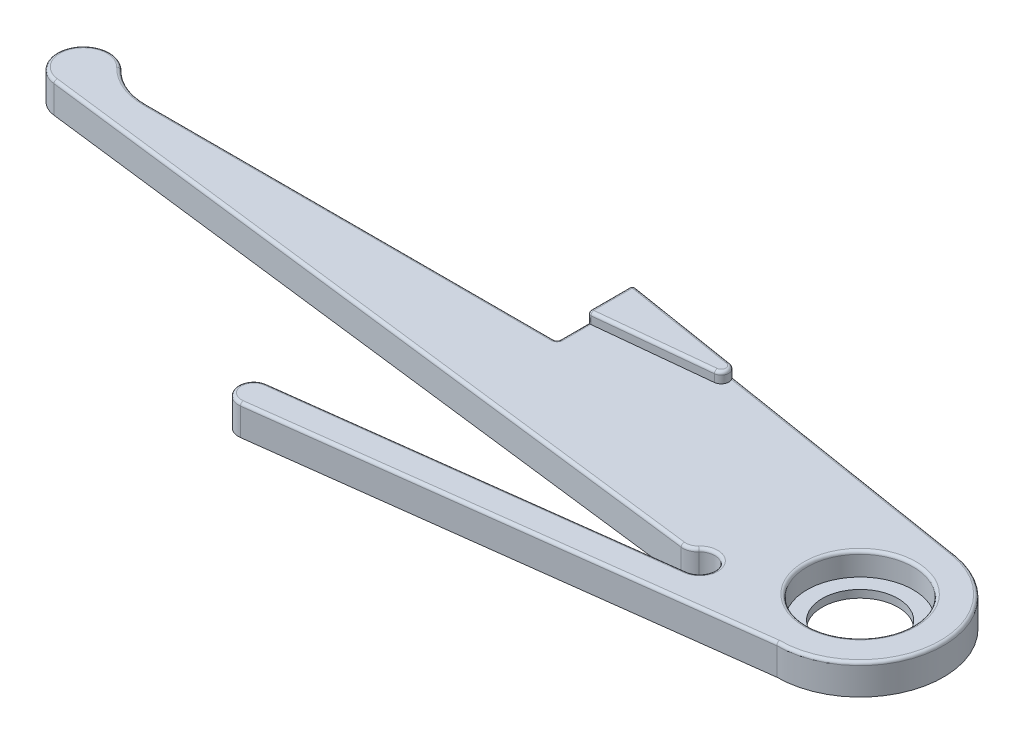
SolidWorks part; units mm, degrees
ref_plane "Спереди" through (0, 0, 0) normal (0, 0, 1) x (1, 0, 0)
ref_plane "Сверху" through (0, 0, 0) normal (0, 1, 0) x (1, 0, 0)
ref_plane "Справа" through (0, 0, 0) normal (1, 0, 0) x (0, 0, -1)
sketch "Эскиз1" plane through (0, 0, 0) normal (0, 1, 0) x (1, 0, 0)
  line L0 (97.0617, 9.5) -> (-94.7203, 9.5) construction
  line L1 (97.0617, 0) -> (-96.214, 0) construction
  line L2 (-24.5, 9.5) -> (0.871, 5.4306)
  line L3 (-24.5, 9.5) -> (-24.5, 4.5)
  line L4 (-24.5, 4.5) -> (-54, 4.5)
  line L5 (-55.9633, 2.7676) -> (-8.7824, -3.0255)
  line L6 (-7.0674, -4.3846) -> (-31.6345, -7.5161)
  line L7 (-31.3816, -9.5) -> (0, -5.5)
  line L8 (97.0617, -9.5) -> (-94.7203, -9.5) construction
  circle A0 centre (0, 0) radius 2.5
  arc A1 (0, -5.5) -> (0.871, 5.4306) centre (0, 0) ccw
  arc A2 (-54, 4.5) -> (-55.9633, 2.7676) centre (-55.75, 4.5045) ccw
  arc A3 (-8.7824, -3.0255) -> (-7.9271, -2.7128) centre (-8.6605, -2.033) ccw
  arc A4 (-7.9271, -2.7128) -> (-7.0674, -4.3846) centre (-7.1938, -3.3927) cw
  arc A6 (-31.6345, -7.5161) -> (-31.3816, -9.5) centre (-31.508, -8.508) ccw
  point P42 (-32.5, -8.6345)
  dimension "D1" = 5
  dimension "D2" = 11
  dimension "D5" = 3.5
  dimension "D8" = 63
  dimension "D9" = 1
  dimension "D11" = 1
  dimension "D3" = 9.5
  dimension "D4" = 30
  dimension "D6" = 2
  dimension "D7" = 5
  dimension "D10" = 7
  dimension "D12" = 38
extrude "Бобышка-Вытянуть1" add sketch "Эскиз1" along normal blind 2
sketch "Эскиз2" plane through (0, 2, 0) normal (0, 1, 0) x (1, 0, 0)
  line L0 (-24.5, 9.5) -> (-24.5, 6.5)
  line L1 (-24.5, 9.5) -> (-24.5, 4.5) construction
  line L2 (-24.5, 6.5) -> (-13.1155, 7.674)
  line L4 (0.871, 5.4306) -> (-24.5, 9.5) construction
  line L5 (-24.5, 9.5) -> (-13.1155, 7.674)
  dimension "D1" = 3
  dimension "D2" = 15
extrude "Бобышка-Вытянуть2" add sketch "Эскиз2" along normal blind 0.7
sketch "Эскиз3" plane through (0, 2, 0) normal (0, 1, 0) x (1, 0, 0)
  circle A0 centre (0, 0) radius 3.5
  dimension "D1" = 7
extrude "Вырез-Вытянуть1" cut sketch "Эскиз3" against normal blind 1.5
fillet "Скругление1" radius 4 1 edges at (-54, 1, -4.5)
ref_plane "Плоскость1" through (-13.1155, 2.7, -7.674) normal (0, -1, 0) x (-1, 0, 0)
fillet "Скругление2" radius 0.5 1 edges at (-13.1155, 2.35, -7.674)
fillet "Скругление3" radius 0.2 1 edges at (0, 2, 3.5)
fillet "Скругление4" radius 0.2 2 edges at (-24.5, 2.35, -6.5) (-24.5, 1.35, -9.5)
fillet "Скругление5" radius 0.2 1 edges at (-24.5, 1, -4.5)
fillet "Скругление6" radius 0.2 19 edges at (-16.4449, 2.7, -7.7677) (-20.5864, 2.7, -6.9036) (-24.434, 2.7, -6.5732) (-24.5, 2.7, -7.9935) (-24.4297, 2.7, -9.4176) (5.4826, 2, 0.4369) (-24.5, 2, -5.7108) (-24.5586, 2, -4.5586) (-15.6908, 2, 7.5) (-32.5, 2, 8.6345) (-19.3509, 2, 5.9503) (-6.3045, 2, 2.9353) (-8.3171, 2, 2.9722) (-32.3728, 2, 0.129) (-57.3162, 2, -5.2851) (-53.1773, 2, -4.8178) (-20.5669, 2.7, -8.8691) (-7.9972, 2, -6.853) (-38.1575, 2, -4.5)
